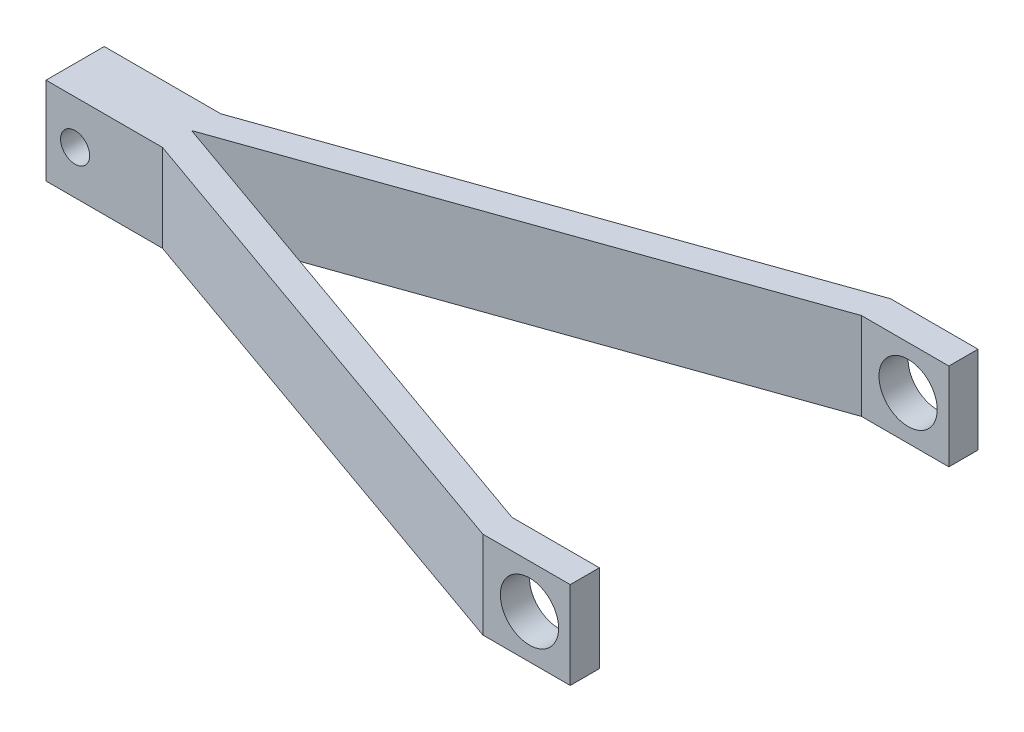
SolidWorks part; units mm, degrees
ref_plane "Front Plane" through (0, 0, 0) normal (0, 0, 1) x (1, 0, 0)
ref_plane "Top Plane" through (0, 0, 0) normal (0, 1, 0) x (1, 0, 0)
ref_plane "Right Plane" through (0, 0, 0) normal (1, 0, 0) x (0, 0, -1)
sketch "Sketch1" plane through (0, 0, 0) normal (0, 1, 0) x (1, 0, 0)
  line L0 (-66.1275, 0) -> (82.0543, 0) construction
  line L1 (100, -35) -> (85, -35)
  line L2 (85, -35) -> (0, -5)
  line L3 (0, -5) -> (-20, -5)
  line L4 (-20, -5) -> (-20, 5)
  line L5 (-20, 0) -> (0, 0)
  line L6 (0, 0) -> (85, -30)
  line L7 (85, -30) -> (100, -30)
  line L8 (100, -30) -> (100, -35)
  line L9 (100, 30) -> (100, 35)
  line L10 (85, 30) -> (100, 30)
  line L11 (0, 0) -> (85, 30)
  line L12 (0, 5) -> (-20, 5)
  line L13 (85, 35) -> (0, 5)
  line L14 (100, 35) -> (85, 35)
  dimension "D1" = 5
  dimension "D2" = 5
  dimension "D3" = 20
  dimension "D4" = 15
  dimension "D5" = 100
  dimension "D6" = 30
extrude "Boss-Extrude1" add sketch "Sketch1" along normal mid plane 15 contours L9 L14 L13 L12 L4 L5 L11 L10 | L8 L7 L6 L5 L4 L3 L2 L1
sketch "Sketch2" plane through (0, 0, 35) normal (0, 0, 1) x (1, 0, 0)
  line L0 (100, 7.5) -> (100, -7.5) construction
  circle A0 centre (93, 0) radius 5
  point P4 (100, 0)
  dimension "D1" = 10
  dimension "D2" = 7
extrude "Cut-Extrude1" cut sketch "Sketch2" against normal through all
sketch "Sketch3" plane through (0, 0, 5) normal (0, 0, 1) x (1, 0, 0)
  circle A0 centre (-15, 0) radius 2.5
  dimension "D1" = 5
  dimension "D2" = 15
extrude "Cut-Extrude2" cut sketch "Sketch3" against normal through all
